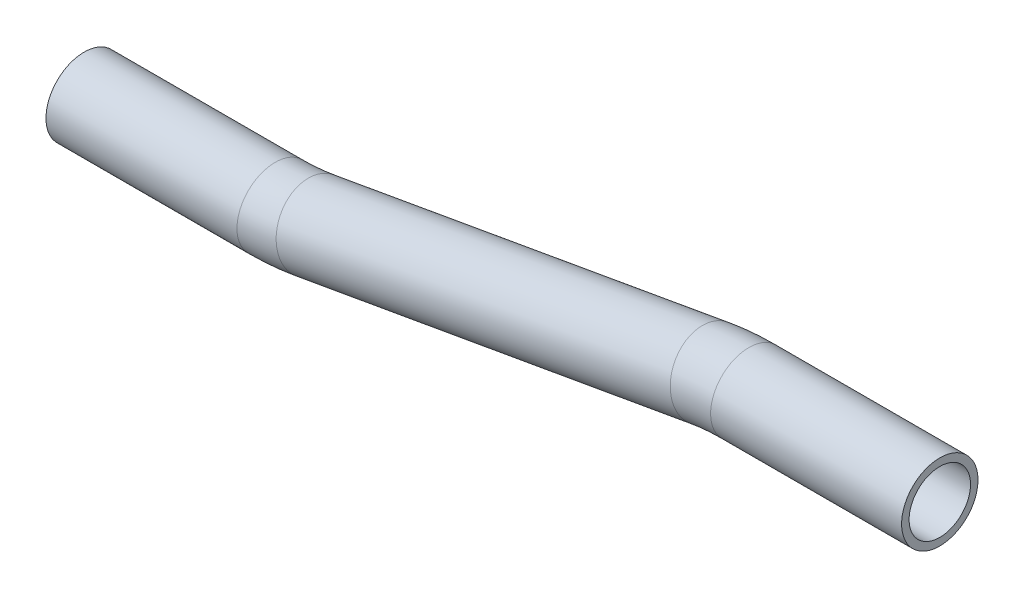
SolidWorks part; units mm, degrees
ref_plane "Front Plane" through (0, 0, 0) normal (0, 0, 1) x (1, 0, 0)
ref_plane "Top Plane" through (0, 0, 0) normal (0, 1, 0) x (1, 0, 0)
ref_plane "Right Plane" through (0, 0, 0) normal (1, 0, 0) x (0, 0, -1)
sketch "Sketch1" plane through (0, 0, 0) normal (1, 0, 0) x (0, 0, -1)
  circle A0 centre (0, 0) radius 5.1054
  circle A1 centre (0, 0) radius 6.35
  dimension "D1" = 12.7
  dimension "D2" = 10.2108
sketch "Sketch2" plane through (0, 0, 0) normal (0, 0, 1) x (1, 0, 0)
  line L0 (0, 0) -> (31.75, 0)
  line L1 (110.49, 12.7) -> (142.24, 12.7)
  line L2 (38.3613, 0.578) -> (103.8787, 12.122)
  arc A0 (31.75, 0) -> (38.3613, 0.578) centre (31.75, 38.1) ccw
  arc A1 (110.49, 12.7) -> (103.8787, 12.122) centre (110.49, -25.4) ccw
  dimension "D5" = 38.1
  dimension "D2" = 142.24
  dimension "D3" = 31.75
  dimension "D4" = 12.7
sweep "Sweep1" add profiles "Sketch1" path "Sketch2"
